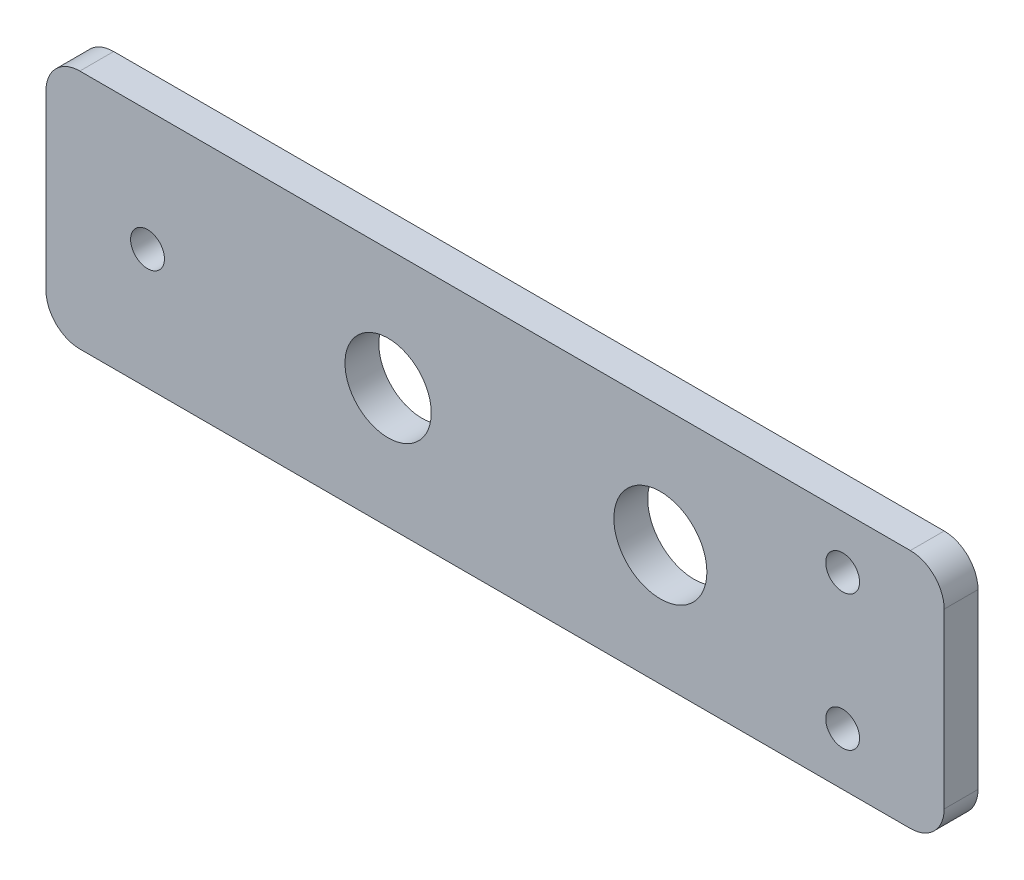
SolidWorks part; units mm, degrees
ref_plane "Front Plane" through (0, 0, 0) normal (0, 0, 1) x (1, 0, 0)
ref_plane "Top Plane" through (0, 0, 0) normal (0, 1, 0) x (1, 0, 0)
ref_plane "Right Plane" through (0, 0, 0) normal (1, 0, 0) x (0, 0, -1)
sketch "Sketch1" plane through (0, 0, 0) normal (0, 0, 1) x (1, 0, 0)
  line L0 (0, 0) -> (-20.437, 0) construction
  line L1 (0, 0) -> (21.3032, 0) construction
  line L6 (21.3032, 9.0359) -> (-46.1178, 9.0359)
  line L7 (0, 0) -> (-20.437, 0) construction
  line L8 (21.3032, 9.0359) -> (21.3032, -9.0359)
  line L9 (21.3032, -9.0359) -> (-46.1178, -9.0359)
  line L10 (-46.1178, 9.0359) -> (-46.1178, -9.0359)
  line L11 (-20.437, 0) -> (-38.4978, 0) construction
  line L12 (-38.4978, 0) -> (-46.1178, 0) construction
  circle A0 centre (0, 0) radius 3.4925
  circle A1 centre (-20.437, 0) radius 3.2385
  circle A2 centre (0, 0) radius 2.54 construction
  circle A3 centre (-20.437, 0) radius 2.1787 construction
  circle A8 centre (-38.4978, 0) radius 1.27
  circle A9 centre (13.6832, 5.08) radius 1.27
  circle A10 centre (13.6832, -5.08) radius 1.27
  dimension "D2" = 7.62
  dimension "D5" = 4.3575
  dimension "D1" = 7.62
other "AlignGroup1"
other "AlignGroup2"
extrude "Boss-Extrude2" add sketch "Sketch1" along normal blind 2.54 contours L9 L10 L6 L8
fillet "Fillet1" radius 2.54 4 edges at (21.3032, -9.0359, 1.27) (21.3032, 9.0359, 1.27) (-46.1178, -9.0359, 1.27) (-46.1178, 9.0359, 1.27)
